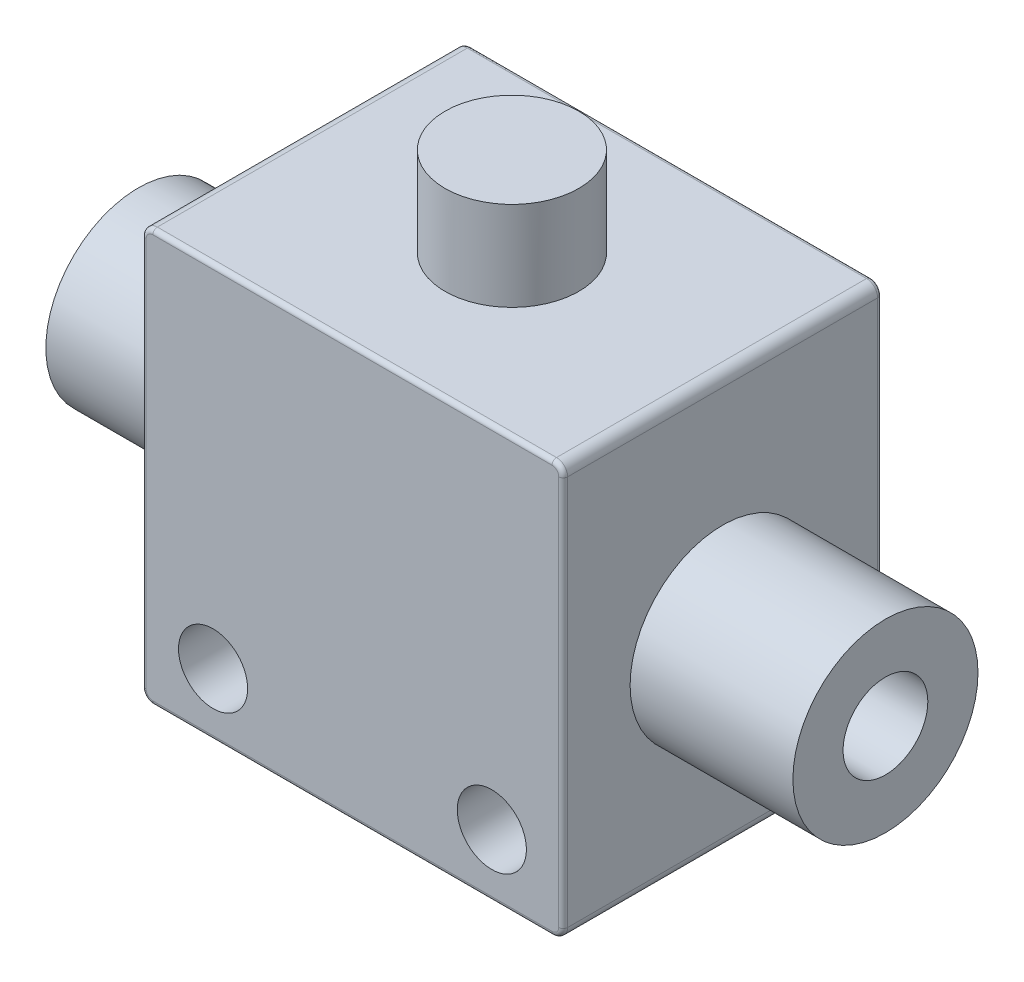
SolidWorks part; units mm, degrees
ref_plane "Front" through (0, 0, 0) normal (0, 0, 1) x (1, 0, 0)
ref_plane "Top" through (0, 0, 0) normal (0, 1, 0) x (1, 0, 0)
ref_plane "Right" through (0, 0, 0) normal (1, 0, 0) x (0, 0, -1)
sketch "Sketch1" plane through (0, 0, 0) normal (0, 1, 0) x (1, 0, 0)
  line L1 (0, 0) -> (24.003, 0)
  line L2 (0, 0) -> (0, 18.161)
  line L3 (0, 18.161) -> (24.003, 18.161)
  line L4 (24.003, 0) -> (24.003, 18.161)
  dimension "D1" = 24.003
  dimension "D2" = 18.161
extrude "Extrude1" add sketch "Sketch1" along normal blind 23.495
sketch "Sketch2" plane through (24.003, 0, 0) normal (1, 0, 0) x (0, 0, -1)
  line L0 (0, 0) -> (18.161, 0) construction
  line L1 (0, 23.495) -> (0, 0) construction
  circle A0 centre (9.0805, 10.795) radius 5.2705
  dimension "D1" = 10.541
  dimension "D2" = 10.795
  dimension "D3" = 9.0805
extrude "Extrude2" add sketch "Sketch2" along normal blind 9.271
sketch "Sketch3" plane through (33.274, 0, 0) normal (1, 0, 0) x (0, 0, -1)
  circle A0 centre (9.0805, 10.795) radius 2.413
  circle A1 centre (9.0805, 10.795) radius 5.2705 construction
  dimension "D1" = 4.826
extrude "Cut-Extrude1" cut sketch "Sketch3" against normal blind 19.05
sketch "Sketch4" plane through (0, 0, 0) normal (0, 0, 1) x (1, 0, 0)
  line L0 (24.003, 23.495) -> (24.003, 0) construction
  line L1 (0, 0) -> (24.003, 0) construction
  circle A0 centre (19.939, 3.556) radius 1.9685
  dimension "D1" = 3.937
  dimension "D2" = 4.064
  dimension "D3" = 3.556
extrude "Cut-Extrude2" cut sketch "Sketch4" against normal through all
ref_plane "Plane1" through (12.0015, 0, 0) normal (1, 0, 0) x (0, 0, -1)
mirror "Mirror1" about plane through (12.0015, 0, 0) normal (1, 0, 0) of "Cut-Extrude2", "Cut-Extrude1", "Extrude2"
fillet "Fillet1" radius 0.635 4 edges at (24.003, 23.495, -9.0805) (0, 23.495, -9.0805) (24.003, 0, -9.0805) (0, 0, -9.0805)
fillet "Fillet2" radius 0.254 16 edges at (24.003, 11.7475, -18.161) (24.003, 11.7475, 0) (12.0015, 0, -18.161) (0, 11.7475, -18.161) (12.0015, 23.495, -18.161) (0.186, 23.309, -18.161) (0.186, 0.186, -18.161) (23.817, 23.309, -18.161) (23.817, 0.186, -18.161) (12.0015, 0, 0) (12.0015, 23.495, 0) (0, 11.7475, 0) (0.186, 23.309, 0) (0.186, 0.186, 0) (23.817, 23.309, 0) (23.817, 0.186, 0)
sketch "Sketch5" plane through (0, 23.495, 0) normal (0, 1, 0) x (-1, 0, 0)
  line L0 (-0.635, -18.161) -> (-23.368, -18.161) construction
  line L1 (-24.003, -17.907) -> (-24.003, -0.254) construction
  circle A0 centre (-12.0015, -9.0805) radius 3.81
  dimension "D3" = 7.62
  dimension "D1" = 9.0805
  dimension "D2" = 12.0015
extrude "Extrude3" add sketch "Sketch5" along normal blind 5.08
equation "\"D3@Sketch2\" = \"D2@Sketch1\"/2"
equation "\"D1@Plane1\" = \"D1@Sketch1\" / 2"
equation "\"D1@Sketch5\" = \"D2@Sketch1\" / 2"
equation "\"D2@Sketch5\" = \"D1@Sketch1\" / 2"
